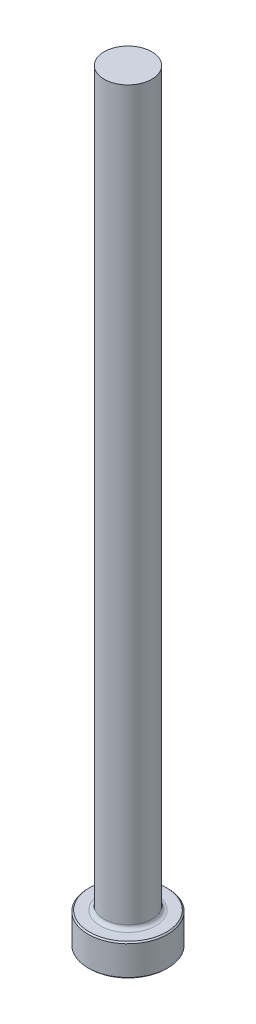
SolidWorks part; units mm, degrees
ref_plane "Front Plane" through (0, 0, 0) normal (0, 0, 1) x (1, 0, 0)
ref_plane "Top Plane" through (0, 0, 0) normal (0, 1, 0) x (1, 0, 0)
ref_plane "Right Plane" through (0, 0, 0) normal (1, 0, 0) x (0, 0, -1)
sketch "Sketch1" plane through (0, 0, 0) normal (0, 0, 1) x (1, 0, 0)
  line L0 (0, 259.9588) -> (0, -15.1925) construction
  line L1 (0, 0) -> (-7.9375, 0)
  line L2 (-7.9375, 0) -> (-7.9375, 6.35)
  line L3 (-7.9375, 6.35) -> (-4.7625, 6.35)
  line L4 (-4.7625, 6.35) -> (-4.7625, 152.4)
  line L5 (-4.7625, 152.4) -> (0, 152.4)
  line L6 (0, 152.4) -> (0, 0)
  dimension "L" = 152.4
  dimension "H" = 15.875
  dimension "T" = 6.35
  dimension "D" = 9.525
revolve "Revolve1" add sketch "Sketch1" angle 360 about L0
chamfer "Chamfer1" distance 0.254 angle 45 2 edges at (0, 6.35, 7.9375) (0, 0, 7.9375)
fillet "Fillet1" radius 0.762 1 edges at (0, 6.35, 4.7625)
sketch "Pocket Sketch" plane through (0, 0, 0) normal (0, 0, 1) x (1, 0, 0)
  line L0 (-8.3344, 0) -> (-8.3344, 6.3754)
  line L1 (-8.3344, 6.3754) -> (-5.9214, 6.3754)
  line L2 (-5.1594, 7.1374) -> (-5.1594, 22.225)
  line L3 (-5.1594, 22.225) -> (0, 22.225)
  line L4 (0, 22.225) -> (0, 0)
  line L5 (0, 0) -> (-8.3344, 0)
  line L6 (0, 12.6104) -> (0, -2.4989) construction
  line L7 (-7.9375, 6.096) -> (-7.9375, 0.254) construction
  line L8 (7.6835, 6.35) -> (-7.6835, 6.35) construction
  line L9 (-4.7625, 152.4) -> (-4.7625, 7.112) construction
  line L10 (-5.9214, 6.3754) -> (-5.1594, 7.1374)
  point P3 (-5.1594, 6.3754)
  dimension "D1" = 16.6687
  dimension "D2" = 0.3969
  dimension "D3" = 0.0254
  dimension "D4" = 0.3969
  dimension "D5" = 10.3187
  dimension "D6" = 22.225
